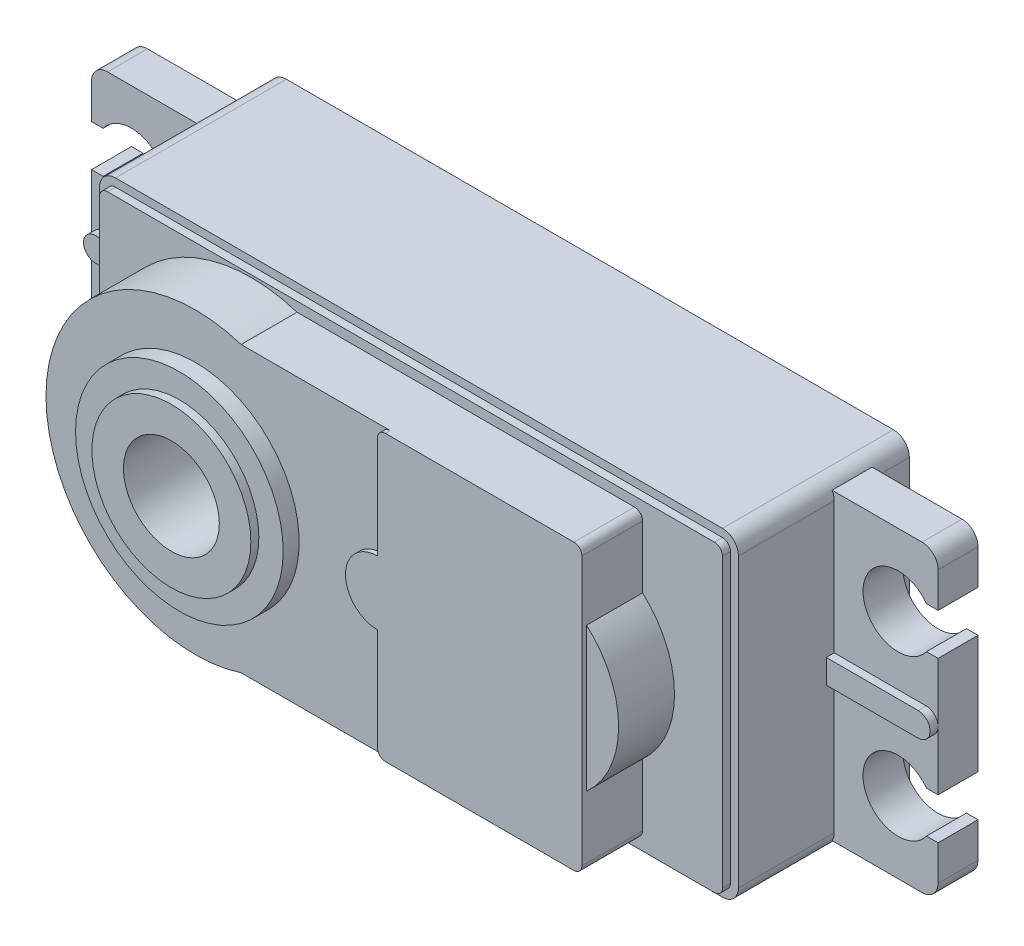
SolidWorks part; units mm, degrees
ref_plane "Přední" through (0, 0, 0) normal (0, 0, 1) x (1, 0, 0)
ref_plane "Horní" through (0, 0, 0) normal (0, 1, 0) x (1, 0, 0)
ref_plane "Pravá" through (0, 0, 0) normal (1, 0, 0) x (0, 0, -1)
sketch "Skica1" plane through (0, 0, 0) normal (0, 0, 1) x (1, 0, 0)
  line L4 (-19, -10) -> (19, -10)
  line L5 (20, -9) -> (20, 9)
  line L6 (19, 10) -> (-19, 10)
  line L7 (-20, 9) -> (-20, -9)
  line L8 (-19, -10) -> (19, -10)
  line L9 (20, -9) -> (20, 9)
  line L10 (19, 10) -> (-19, 10)
  line L11 (-20, 9) -> (-20, -9)
  arc A4 (-20, -9) -> (-19, -10) centre (-19, -9) ccw
  arc A5 (19, -10) -> (20, -9) centre (19, -9) ccw
  arc A6 (20, 9) -> (19, 10) centre (19, 9) ccw
  arc A7 (-19, 10) -> (-20, 9) centre (-19, 9) ccw
  arc A8 (-20, -9) -> (-19, -10) centre (-19, -9) ccw
  arc A9 (19, -10) -> (20, -9) centre (19, -9) ccw
  arc A10 (20, 9) -> (19, 10) centre (19, 9) ccw
  arc A11 (-19, 10) -> (-20, 9) centre (-19, 9) ccw
  dimension "D1" = 0
extrude "Základ-Protažení" add sketch "Skica1" along normal blind 10.7
sketch "Skica2" plane through (0, 0, 10.7) normal (0, 0, 1) x (1, 0, 0)
  line L8 (-19, -9.5) -> (19, -9.5)
  line L9 (19.5, -9) -> (19.5, 9)
  line L10 (19, 9.5) -> (-19, 9.5)
  line L11 (-19.5, 9) -> (-19.5, -9)
  line L12 (-19, -9.5) -> (19, -9.5)
  line L13 (19.5, -9) -> (19.5, 9)
  line L14 (19, 9.5) -> (-19, 9.5)
  line L15 (-19.5, 9) -> (-19.5, -9)
  arc A8 (-19.5, -9) -> (-19, -9.5) centre (-19, -9) ccw
  arc A9 (19, -9.5) -> (19.5, -9) centre (19, -9) ccw
  arc A10 (19.5, 9) -> (19, 9.5) centre (19, 9) ccw
  arc A11 (-19, 9.5) -> (-19.5, 9) centre (-19, 9) ccw
  arc A12 (-19.5, -9) -> (-19, -9.5) centre (-19, -9) ccw
  arc A13 (19, -9.5) -> (19.5, -9) centre (19, -9) ccw
  arc A14 (19.5, 9) -> (19, 9.5) centre (19, 9) ccw
  arc A15 (-19, 9.5) -> (-19.5, 9) centre (-19, 9) ccw
  dimension "D1" = 0.5
extrude "Přidání-Protažení1" add sketch "Skica2" along normal blind 0.5
sketch "Skica3" plane through (0, 0, 11.2) normal (0, 0, 1) x (1, 0, 0)
  line L0 (-19.5, 0) -> (19.5, 0) construction
  line L1 (-19.5, 9) -> (-19.5, -9) construction
  line L2 (19.5, -9) -> (19.5, 9) construction
  line L3 (-7.1343, 8.9) -> (14, 8.9)
  line L4 (-7.1343, -8.9) -> (14, -8.9)
  line L5 (14.5, 8.4) -> (14.5, 4.5)
  line L6 (16.5, 5.8264) -> (16.5, -5.8264) construction
  line L7 (14.5, -4.5) -> (14.5, -8.4)
  line L8 (-20, 9) -> (-20, -9) construction
  arc A0 (-7.1343, 8.9) -> (-7.1343, -8.9) centre (-10, 0) ccw
  arc A2 (14, 8.9) -> (14.5, 8.4) centre (14, 8.4) cw
  arc A3 (14.5, -4.5) -> (14.5, 4.5) centre (10.4375, 0) ccw
  arc A4 (14, -8.9) -> (14.5, -8.4) centre (14, -8.4) ccw
  point P20 (16.5, 0)
  point P21 (14.5, 8.9)
  point P24 (14.5, -8.9)
  dimension "D1" = 18.7
  dimension "D6" = 0.5
  dimension "D2" = 17.8
  dimension "D3" = 36
  dimension "D4" = 9
  dimension "D5" = 34
  dimension "D7" = 10
extrude "Přidání-Protažení2" add sketch "Skica3" along normal blind 3.5
sketch "Skica4" plane through (0, 0, 14.7) normal (0, 0, 1) x (1, 0, 0)
  line L0 (1.7, -8.4) -> (1.7, -2)
  line L1 (14.5, 0) -> (-1.3994, 0) construction
  line L2 (1.7, 2) -> (1.7, 8.4)
  line L4 (14, 8.9) -> (-7.1343, 8.9)
  line L5 (-7.1343, -8.9) -> (14, -8.9)
  line L6 (14.5, -8.4) -> (14.5, -4.5)
  line L7 (14.5, 4.5) -> (14.5, 8.4)
  line L8 (14, 8.9) -> (2.2, 8.9)
  line L9 (2.2, -8.9) -> (14, -8.9)
  line L10 (14.5, -8.4) -> (14.5, 8.4)
  arc A0 (1.7, -8.4) -> (2.2, -8.9) centre (2.2, -8.4) ccw
  arc A1 (1.7, 8.4) -> (2.2, 8.9) centre (2.2, 8.4) cw
  arc A2 (1.7, 2) -> (1.7, -2) centre (1.7, 0) ccw
  arc A4 (14.5, 8.4) -> (14, 8.9) centre (14, 8.4) ccw
  arc A5 (-7.1343, 8.9) -> (-7.1343, -8.9) centre (-10, 0) ccw
  arc A6 (14, -8.9) -> (14.5, -8.4) centre (14, -8.4) ccw
  arc A7 (14.5, -4.5) -> (14.5, 4.5) centre (10.4375, 0) ccw
  arc A8 (14.5, 8.4) -> (14, 8.9) centre (14, 8.4) ccw
  arc A10 (14, -8.9) -> (14.5, -8.4) centre (14, -8.4) ccw
  dimension "D2" = 12.8
  dimension "D3" = 4
  dimension "D1" = 0
extrude "Přidání-Protažení3" add sketch "Skica4" along normal blind 0.3
sketch "Skica5" plane through (0, 0, 14.7) normal (0, 0, 1) x (1, 0, 0)
  circle A0 centre (-10, 0) radius 6.5
  arc A1 (-7.1343, 8.9) -> (-7.1343, -8.9) centre (-10, 0) ccw construction
  dimension "D1" = 13
extrude "Přidání-Protažení5" add sketch "Skica5" along normal blind 1
sketch "Skica6" plane through (0, 0, 15.7) normal (0, 0, 1) x (1, 0, 0)
  circle A0 centre (-10, 0) radius 4.975
  dimension "D1" = 9.95
extrude "Přidání-Protažení6" add sketch "Skica6" along normal blind 0.5
sketch "Skica7" plane through (0, 0, 16.2) normal (0, 0, 1) x (1, 0, 0)
  circle A0 centre (-10, 0) radius 3
  dimension "D1" = 6
extrude "Odebrání-Protažení1" cut sketch "Skica7" against normal through all
ref_plane "Rovina1" through (0, 0, 2.2) normal (0, 0, -1) x (-1, 0, 0)
sketch "Skica8" plane through (0, 0, 2.2) normal (0, 0, -1) x (-1, 0, 0)
  line L0 (-22.8205, 0) -> (22.5128, 0) construction
  line L1 (19.866, 9.5) -> (25.5, 9.5)
  line L2 (19.866, -9.5) -> (25.5, -9.5)
  line L3 (26.5, 8.5) -> (26.5, 6.3)
  line L4 (25.7748, 6.3) -> (26.5, 6.3)
  line L5 (25.7748, -6.3) -> (26.5, -6.3)
  line L6 (25.7748, 3.7) -> (26.5, 3.7)
  line L7 (25.7748, -3.7) -> (26.5, -3.7)
  line L8 (21.5885, 5) -> (27.3455, 5) construction
  line L9 (21.5885, -5) -> (27.3455, -5) construction
  line L10 (26.5, 3.7) -> (26.5, -3.7)
  line L11 (26.5, -6.3) -> (26.5, -8.5)
  line L12 (19.866, 9.5) -> (19.866, -9.5)
  line L13 (0, 12.1276) -> (0, -12.1415) construction
  arc A0 (26.5, 8.5) -> (25.5, 9.5) centre (25.5, 8.5) ccw
  arc A1 (25.5, -9.5) -> (26.5, -8.5) centre (25.5, -8.5) ccw
  arc A2 (25.7748, 6.3) -> (25.7748, 3.7) centre (24, 5) ccw
  arc A3 (25.7748, -6.3) -> (25.7748, -3.7) centre (24, -5) cw
  arc A4 (20, 9) -> (19, 10) centre (19, 9) ccw construction
  point P11 (26.5, 9.5)
  point P14 (26.5, -9.5)
  dimension "D1" = 1
  dimension "D2" = 4.4
  dimension "D6" = 48
  dimension "D3" = 10
  dimension "D4" = 2.6
  dimension "D5" = 53
  dimension "D7" = 19
extrude "Přidání-Protažení7" add sketch "Skica8" against normal blind 2.5
sketch "Skica9" plane through (0, 0, 4.7) normal (0, 0, 1) x (1, 0, 0)
  line L0 (-20, 0) -> (-29.0207, 0) construction
  line L1 (-20, -9) -> (-20, 9) construction
  line L2 (-20, 0.75) -> (-25.75, 0.75)
  line L3 (-20, -0.75) -> (-25.75, -0.75)
  line L4 (-26.5, 0) -> (-26.5, -3.3472) construction
  line L5 (-20, 0.75) -> (-20, -0.75)
  line L6 (-26.5, -3.7) -> (-26.5, 3.7) construction
  arc A0 (-25.75, 0.75) -> (-25.75, -0.75) centre (-25.75, 0) ccw
  dimension "D1" = 1.5
extrude "Přidání-Protažení8" add sketch "Skica9" along normal offset from surface (0.5 mm away) 6
mirror "Zrcadlení1" about plane through (0, 0, 0) normal (1, 0, 0) of "Přidání-Protažení8", "Přidání-Protažení7"
